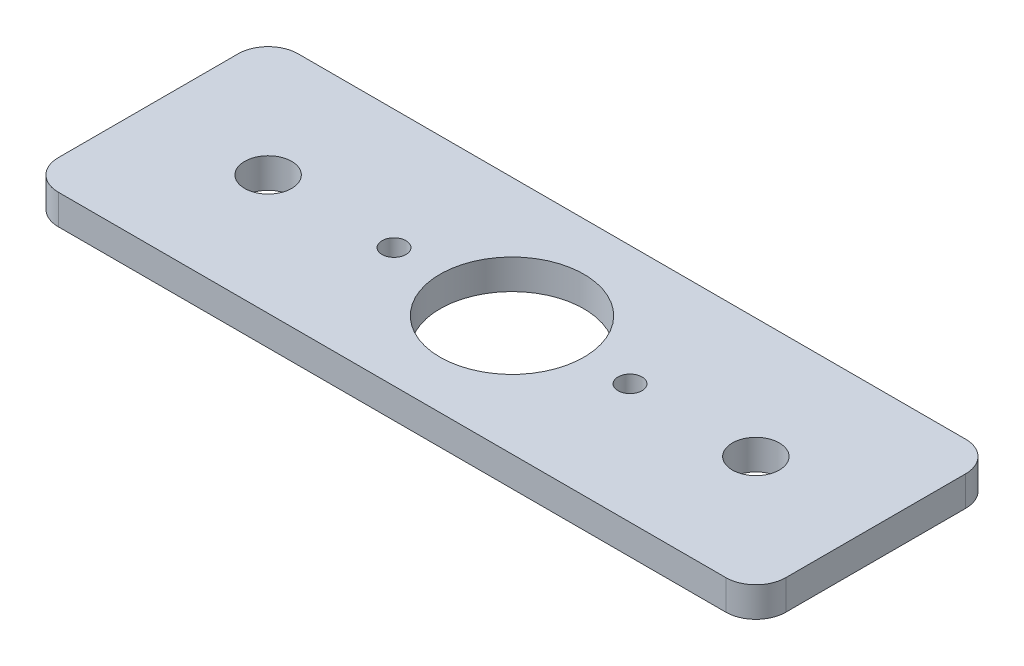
SolidWorks part; units mm, degrees
ref_plane "Front Plane" through (0, 0, 0) normal (0, 0, 1) x (1, 0, 0)
ref_plane "Top Plane" through (0, 0, 0) normal (0, 1, 0) x (1, 0, 0)
ref_plane "Right Plane" through (0, 0, 0) normal (1, 0, 0) x (0, 0, -1)
sketch "Sketch1" plane through (0, 0, 0) normal (0, 1, 0) x (1, 0, 0)
  line L0 (0, 12.7) -> (77.0636, 12.7) construction
  line L1 (0, 0) -> (77.0636, 0)
  line L2 (0, 0) -> (0, 25.4)
  line L3 (0, 25.4) -> (77.0636, 25.4)
  line L4 (77.0636, 0) -> (77.0636, 25.4)
  line L5 (38.5318, 25.4) -> (38.5318, 0) construction
  circle A0 centre (38.5318, 12.7) radius 7.62
  circle A1 centre (51.0318, 12.7) radius 1.27
  circle A2 centre (26.0318, 12.7) radius 1.27
  circle A3 centre (38.5318, 12.7) radius 12.5 construction
  circle A4 centre (64.3636, 12.7) radius 2.4892
  circle A5 centre (12.7, 12.7) radius 2.4892
  dimension "D3" = 25
  dimension "D4" = 15.24
  dimension "D5" = 2.54
  dimension "D6" = 4.9784
  dimension "D9" = 51.6636
  dimension "D1" = 25.4
  dimension "D2" = 77.0636
  dimension "D7" = 12.7
  dimension "D8" = 12.7
extrude "Boss-Extrude1" add sketch "Sketch1" along normal blind 3.175
fillet "Fillet1" radius 3.175 4 edges at (0, 1.5875, -25.4) (77.0636, 1.5875, -25.4) (77.0636, 1.5875, 0) (0, 1.5875, 0)
